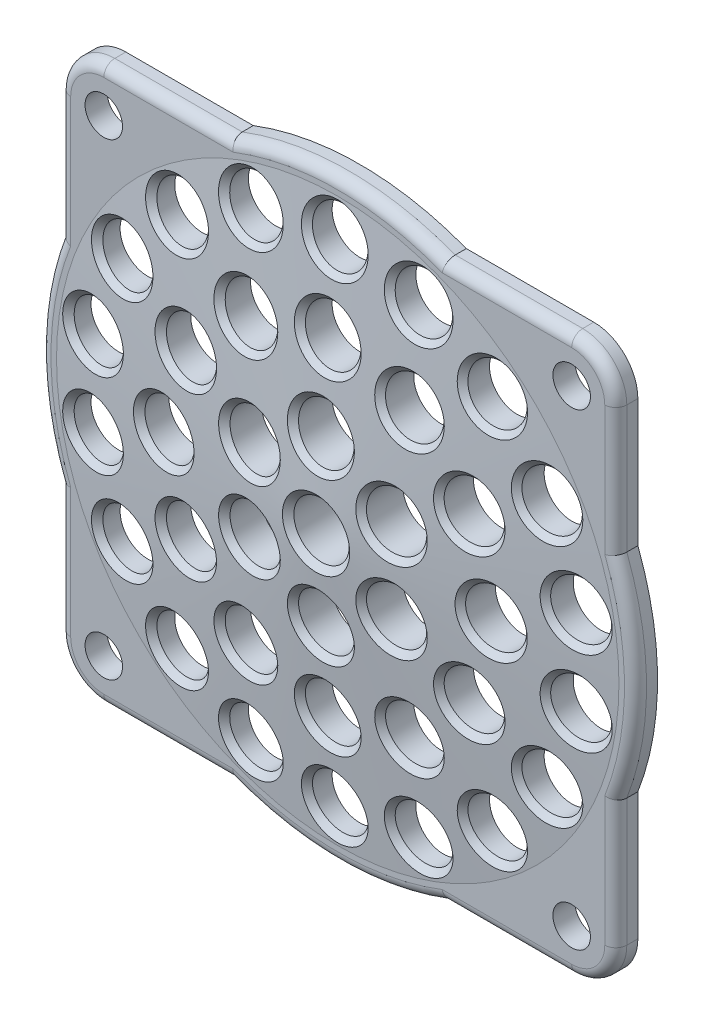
SolidWorks part; units mm, degrees
ref_plane "Спереди" through (0, 0, 0) normal (0, 0, 1) x (1, 0, 0)
ref_plane "Сверху" through (0, 0, 0) normal (0, 1, 0) x (1, 0, 0)
ref_plane "Справа" through (0, 0, 0) normal (1, 0, 0) x (0, 0, -1)
sketch "Эскиз1" plane through (0, 0, 0) normal (0, 0, 1) x (1, 0, 0)
  line L0 (-25.2132, 21.2132) -> (-25.2132, 9.6589)
  line L6 (-21.2132, -21.2132) -> (0, 0) construction
  line L7 (-21.2132, 25.2132) -> (-9.6589, 25.2132)
  line L8 (21.2132, 25.2132) -> (9.6589, 25.2132)
  line L9 (25.2132, 21.2132) -> (25.2132, 9.6589)
  line L10 (-25.2132, -21.2132) -> (-25.2132, -9.6589)
  line L11 (-21.2132, -25.2132) -> (-9.6589, -25.2132)
  line L12 (25.2132, -21.2132) -> (25.2132, -9.6589)
  line L13 (21.2132, -25.2132) -> (9.6589, -25.2132)
  arc A3 (-25.2132, -21.2132) -> (-21.2132, -25.2132) centre (-21.2132, -21.2132) ccw
  arc A4 (-25.2132, 9.6589) -> (-25.2132, -9.6589) centre (0, 0) ccw
  arc A6 (9.6589, 25.2132) -> (-9.6589, 25.2132) centre (0, 0) ccw
  arc A7 (25.2132, -9.6589) -> (25.2132, 9.6589) centre (0, 0) ccw
  arc A8 (-21.2132, 25.2132) -> (-25.2132, 21.2132) centre (-21.2132, 21.2132) ccw
  arc A10 (25.2132, 21.2132) -> (21.2132, 25.2132) centre (21.2132, 21.2132) ccw
  arc A11 (21.2132, -25.2132) -> (25.2132, -21.2132) centre (21.2132, -21.2132) ccw
  arc A13 (-9.6589, -25.2132) -> (9.6589, -25.2132) centre (0, 0) ccw
  point P0 (0, 0)
  point P6 (0, 0)
  dimension "D3" = 54
  dimension "D1" = 60
extrude "Бобышка-Вытянуть1" add sketch "Эскиз1" along normal blind 2
sketch "Эскиз2" plane through (0, 0, 2) normal (0, 0, 1) x (1, 0, 0)
  circle A0 centre (-21.2132, 21.2132) radius 1.7
  circle A1 centre (21.2132, 21.2132) radius 1.7
  circle A2 centre (21.2132, -21.2132) radius 1.7
  circle A3 centre (-21.2132, -21.2132) radius 1.7
  dimension "D1" = 3.4
extrude "Вырез-Вытянуть1" cut sketch "Эскиз2" against normal through all
sketch "Эскиз20" plane through (0, 0, 2) normal (0, 0, 1) x (1, 0, 0)
  circle A0 centre (0, 0) radius 25.5
  dimension "D1" = 51
extrude "Бобышка-Вытянуть2" add sketch "Эскиз20" along normal blind 2 draft 85
sketch "Эскиз21" plane through (0, 0, 4) normal (0, 0, 1) x (1, 0, 0)
  line L0 (0, 25.5) -> (0, 0) construction
  circle A0 centre (0, 0) radius 25.5 construction
  circle A1 centre (0, 0) radius 2.5094
  circle A2 centre (0, 7.4) radius 2.5094
  circle A3 centre (0, 14.8) radius 2.5094
  circle A4 centre (0, 22.2) radius 2.5094
  circle A5 centre (7.5928, 20.8612) radius 2.5094
  circle A6 centre (14.2699, 17.0062) radius 2.5094
  circle A7 centre (19.2258, 11.1) radius 2.5094
  circle A8 centre (21.8627, 3.855) radius 2.5094
  circle A9 centre (21.8627, -3.855) radius 2.5094
  circle A10 centre (19.2258, -11.1) radius 2.5094
  circle A11 centre (14.2699, -17.0062) radius 2.5094
  circle A12 centre (7.5928, -20.8612) radius 2.5094
  circle A13 centre (0, -22.2) radius 2.5094
  circle A14 centre (-7.5928, -20.8612) radius 2.5094
  circle A15 centre (-14.2699, -17.0062) radius 2.5094
  circle A16 centre (-19.2258, -11.1) radius 2.5094
  circle A17 centre (-21.8627, -3.855) radius 2.5094
  circle A18 centre (-21.8627, 3.855) radius 2.5094
  circle A19 centre (-19.2258, 11.1) radius 2.5094
  circle A20 centre (-14.2699, 17.0062) radius 2.5094
  circle A21 centre (-7.5928, 20.8612) radius 2.5094
  circle A22 centre (7.4, 12.8172) radius 2.5094
  circle A23 centre (12.8172, 7.4) radius 2.5094
  circle A24 centre (14.8, 0) radius 2.5094
  circle A25 centre (12.8172, -7.4) radius 2.5094
  circle A26 centre (7.4, -12.8172) radius 2.5094
  circle A27 centre (0, -14.8) radius 2.5094
  circle A28 centre (-7.4, -12.8172) radius 2.5094
  circle A29 centre (-12.8172, -7.4) radius 2.5094
  circle A30 centre (-14.8, 0) radius 2.5094
  circle A31 centre (-12.8172, 7.4) radius 2.5094
  circle A32 centre (-7.4, 12.8172) radius 2.5094
  circle A33 centre (6.4086, 3.7) radius 2.5094
  circle A34 centre (6.4086, -3.7) radius 2.5094
  circle A35 centre (0, -7.4) radius 2.5094
  circle A36 centre (-6.4086, -3.7) radius 2.5094
  circle A37 centre (-6.4086, 3.7) radius 2.5094
  point P49 (0, 0)
  point P72 (0, 0)
  point P83 (0, 0)
  dimension "D1" = 4
  dimension "D2" = 18
  dimension "D3" = 12
  dimension "D4" = 6
extrude "Вырез-Вытянуть3" cut sketch "Эскиз21" against normal through all
fillet "Скругление1" radius 1 16 edges at (-15.4361, 25.2132, 2) (-24.0416, 24.0416, 2) (-25.2132, -15.4361, 2) (-24.0416, -24.0416, 2) (15.4361, -25.2132, 2) (24.0416, -24.0416, 2) (25.2132, 15.4361, 2) (24.0416, 24.0416, 2) (0, 27, 2) (-25.2132, 15.4361, 2) (-27, 0, 2) (-15.4361, -25.2132, 2) (0, -27, 2) (25.2132, -15.4361, 2) (27, 0, 2) (15.4361, 25.2132, 2)
fillet "Скругление7" radius 0.5 37 edges at (2.1609, -20.9243, 2.3906) (-19.7504, -2.5004, 2.4892) (-5.2629, -11.502, 3.1243) (-12.1318, -15.6926, 2.4956) (-5.4422, -19.5683, 2.454) (-17.1012, -9.7647, 2.5081) (-10.685, -6.0769, 3.1555) (-12.6723, 1.3303, 3.1162) (-19.7592, 5.2231, 2.4429) (-17.1255, 12.4732, 2.3774) (-10.6888, 8.7293, 3.0236) (-4.256, 4.9896, 3.6572) (-4.2693, -2.3883, 3.803) (2.121, -6.059, 3.6693) (2.1408, -13.4909, 3.0359) (9.76, -19.5962, 2.3156) (16.4383, -15.7433, 2.2396) (9.5413, -11.5089, 2.923) (21.3905, -9.8308, 2.1714) (24.0105, 5.1527, 2.0825) (24.0196, -2.5726, 2.1175) (14.9534, -6.0834, 2.8186) (8.5155, -2.337, 3.4584) (16.9292, 1.328, 2.7453) (14.947, 8.7269, 2.7167) (21.3652, 12.4114, 2.0692) (16.4023, 18.329, 2.079) (9.5383, 14.1305, 2.7394) (2.1412, 16.1085, 2.8093) (9.7184, 22.195, 2.1112) (2.1176, 23.5464, 2.1626) (-5.4837, 22.2207, 2.2286) (-12.1671, 18.3756, 2.3028) (-5.2649, 14.1355, 2.9113) (2.1681, 8.6634, 3.4496) (8.5229, 5.0516, 3.3642) (2.5094, 0, 4)
